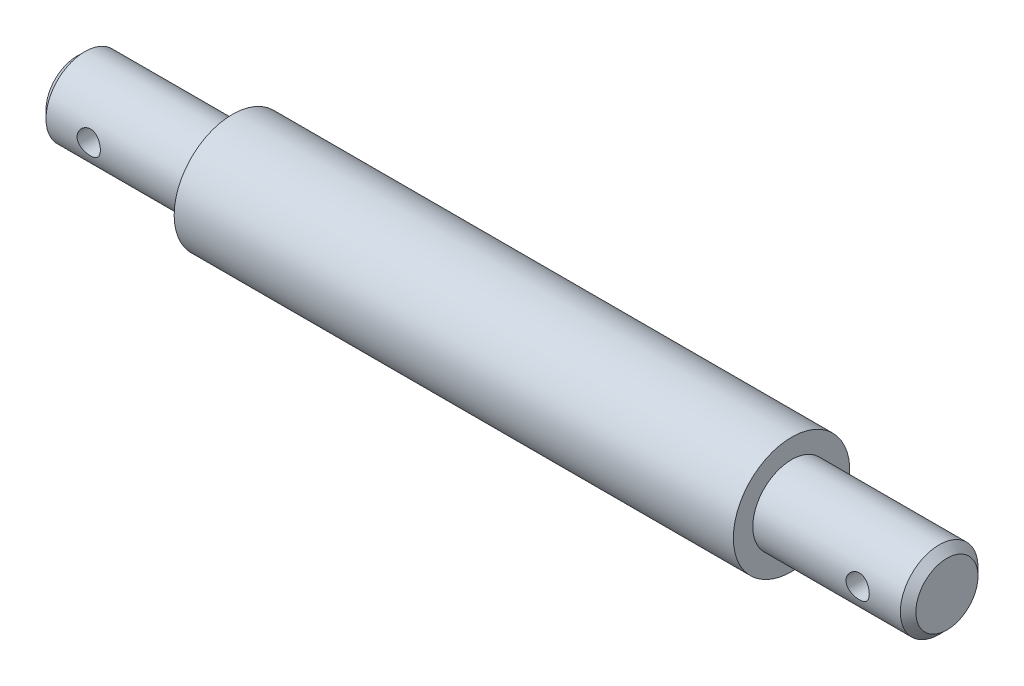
SolidWorks part; units mm, degrees
ref_plane "Face" through (0, 0, 0) normal (0, 0, 1) x (1, 0, 0)
ref_plane "Dessus" through (0, 0, 0) normal (0, 1, 0) x (1, 0, 0)
ref_plane "Droite" through (0, 0, 0) normal (1, 0, 0) x (0, 0, -1)
sketch "Esquisse1" plane through (0, 0, 0) normal (0, 0, 1) x (1, 0, 0)
  line L0 (-59.9259, 0) -> (62.7991, 0) construction
  line L1 (-51.7169, 0) -> (-51.7169, 4)
  line L2 (-50.7169, 5) -> (-31.7169, 5)
  line L3 (-31.7169, 5) -> (-31.7169, 7.5)
  line L4 (-31.7169, 7.5) -> (40.2831, 7.5)
  line L5 (40.2831, 7.5) -> (40.2831, 5)
  line L6 (40.2831, 5) -> (59.2831, 5)
  line L7 (60.2831, 4) -> (60.2831, 0)
  line L8 (-51.7169, 0) -> (60.2831, 0)
  line L9 (-51.7169, 4) -> (-50.7169, 5)
  line L10 (59.2831, 5) -> (60.2831, 4)
  point P4 (-51.7169, 5)
  point P10 (60.2831, 5)
  dimension "D1" = 10
  dimension "D2" = 15
  dimension "D3" = 20
  dimension "D4" = 20
  dimension "D5" = 72
  dimension "D8" = 1
  dimension "D9" = 1
revolve "Révolution1" add sketch "Esquisse1" angle 360 about L0
sketch "Esquisse2" plane through (0, 0, 0) normal (0, 0, 1) x (1, 0, 0)
  line L0 (-59.9259, 0) -> (62.7991, 0) construction
  line L1 (-51.7169, 4) -> (-51.7169, -4) construction
  line L2 (60.2831, -4) -> (60.2831, 4) construction
  circle A0 centre (-45.2169, 0) radius 1.5
  circle A1 centre (53.7831, 0) radius 1.5
  dimension "D3" = 3
  dimension "D4" = 3
  dimension "D1" = 6.5
  dimension "D2" = 6.5
extrude "Enlèv. mat.-Extru.1" cut sketch "Esquisse2" against normal mid plane 40
